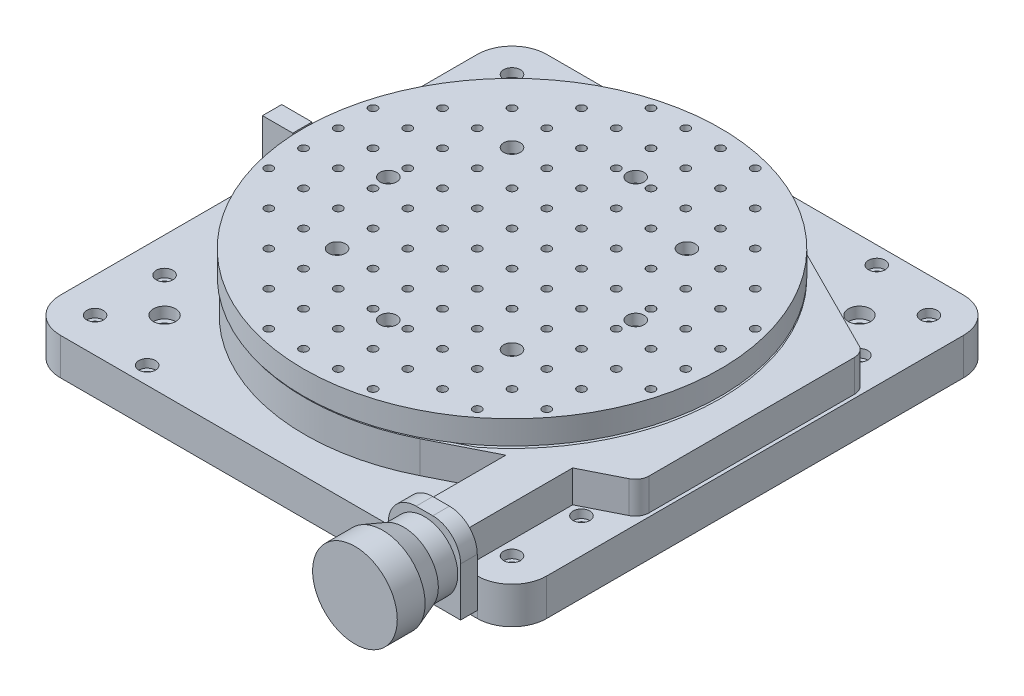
SolidWorks part; units mm, degrees
ref_plane "Front Plane" through (0, 0, 0) normal (0, 0, 1) x (1, 0, 0)
ref_plane "Top Plane" through (0, 0, 0) normal (0, 1, 0) x (1, 0, 0)
ref_plane "Right Plane" through (0, 0, 0) normal (1, 0, 0) x (0, 0, -1)
sketch "Sketch1" plane through (0, 0, 0) normal (0, 1, 0) x (1, 0, 0)
  line L1 (-150, 175) -> (150, 175)
  line L2 (-175, 150) -> (-175, -150)
  line L3 (-150, -175) -> (91, -175)
  line L4 (175, 150) -> (175, -130)
  line L5 (-175, 175) -> (175, -175) construction
  line L6 (-175, -175) -> (175, 175) construction
  line L9 (175, -130) -> (91, -130)
  line L10 (91, -175) -> (91, -130)
  arc A0 (-150, -175) -> (-175, -150) centre (-150, -150) cw
  arc A1 (175, 150) -> (150, 175) centre (150, 150) ccw
  arc A2 (-150, 175) -> (-175, 150) centre (-150, 150) ccw
  circle A3 centre (0, 0) radius 45
  point P0 (0, 0)
  dimension "D3" = 25
  dimension "D6" = 90
  dimension "D1" = 350
  dimension "D2" = 350
  dimension "D4" = 84
  dimension "D5" = 45
extrude "Boss-Extrude1" add sketch "Sketch1" along normal blind 26.5
sketch "Sketch2" plane through (0, 26.5, 0) normal (0, 1, 0) x (1, 0, 0)
  line L0 (172.5, 73.8373) -> (172.5, -73.8373)
  line L1 (175, -130) -> (175, 150) construction
  line L2 (66.9742, 133.0994) -> (166.9949, 82.7701)
  line L3 (66.9742, -133.0994) -> (166.9949, -82.7701)
  line L4 (66.0752, -131.3129) -> (166.0959, -80.9835)
  line L5 (170.5, 73.8373) -> (170.5, -73.8373)
  line L6 (66.0752, 131.3129) -> (166.0959, 80.9835)
  arc A0 (66.9742, 133.0994) -> (66.9742, -133.0994) centre (0, 0) ccw
  arc A1 (166.9949, 82.7701) -> (172.5, 73.8373) centre (162.5, 73.8373) cw
  arc A2 (172.5, -73.8373) -> (166.9949, -82.7701) centre (162.5, -73.8373) cw
  arc A3 (66.0752, 131.3129) -> (66.0752, -131.3129) centre (0, 0) ccw
  arc A4 (170.5, -73.8373) -> (166.0959, -80.9835) centre (162.5, -73.8373) cw
  arc A5 (166.0959, 80.9835) -> (170.5, 73.8373) centre (162.5, 73.8373) cw
  point P11 (172.5, 80)
  point P14 (172.5, -80)
  dimension "D1" = 298
  dimension "D5" = 10
  dimension "D2" = 2.5
  dimension "D3" = 80
  dimension "D4" = 80
  dimension "D6" = 2
extrude "Boss-Extrude2" add sketch "Sketch2" along normal blind 23
sketch "Sketch3" plane through (0, 26.5, 0) normal (0, 1, 0) x (1, 0, 0)
  circle A0 centre (0, 0) radius 45
  circle A1 centre (0, 0) radius 55.7582
extrude "Boss-Extrude3" add sketch "Sketch3" along normal blind 24.5
sketch "Sketch4" plane through (0, 51, 0) normal (0, 1, 0) x (1, 0, 0)
  circle A0 centre (0, 0) radius 150
  circle A1 centre (0, 0) radius 45
  dimension "D1" = 300
extrude "Boss-Extrude4" add sketch "Sketch4" along normal blind 17
sketch "Sketch5" plane through (0, 49.5, 0) normal (0, 1, 0) x (1, 0, 0)
  line L3 (66.9742, -133.0994) -> (166.9949, -82.7701)
  line L4 (172.5, -73.8373) -> (172.5, 73.8373)
  line L5 (166.9949, 82.7701) -> (66.9742, 133.0994)
  line L6 (82.4205, -125.327) -> (166.9949, -82.7701)
  line L7 (172.5, -73.8373) -> (172.5, 73.8373)
  line L8 (166.9949, 82.7701) -> (82.4205, 125.327)
  circle A1 centre (0, 0) radius 150
  arc A2 (82.4205, -125.327) -> (82.4205, 125.327) centre (0, 0) ccw
  arc A3 (66.9742, 133.0994) -> (66.9742, -133.0994) centre (0, 0) ccw
  arc A4 (166.9949, -82.7701) -> (172.5, -73.8373) centre (162.5, -73.8373) ccw
  arc A5 (172.5, 73.8373) -> (166.9949, 82.7701) centre (162.5, 73.8373) ccw
  arc A7 (166.9949, -82.7701) -> (172.5, -73.8373) centre (162.5, -73.8373) ccw
  arc A8 (172.5, 73.8373) -> (166.9949, 82.7701) centre (162.5, 73.8373) ccw
  dimension "D1" = 0
  dimension "D2" = 0
extrude "Boss-Extrude6" add sketch "Sketch5" against normal blind 2
sketch "Sketch7" plane through (0, 0, 130) normal (0, 0, 1) x (1, 0, 0)
  line L0 (91, 0) -> (175, 0) construction
  line L1 (99, 64) -> (149, 64)
  line L2 (94, 59) -> (94, 6)
  line L3 (99, 1) -> (149, 1)
  line L4 (154, 59) -> (154, 6)
  line L7 (175, 26.5) -> (175, 0) construction
  arc A0 (154, 59) -> (149, 64) centre (149, 59) ccw
  arc A1 (99, 64) -> (94, 59) centre (99, 59) ccw
  arc A2 (94, 6) -> (99, 1) centre (99, 6) ccw
  arc A3 (149, 1) -> (154, 6) centre (149, 6) ccw
  point P0 (124, 32.5)
  point P11 (154, 64)
  point P18 (154, 1)
  dimension "D6" = 5
  dimension "D1" = 32.5
  dimension "D2" = 31.5
  dimension "D3" = 63
  dimension "D4" = 51
  dimension "D5" = 60
extrude "Boss-Extrude7" add sketch "Sketch7" along normal blind 21
sketch "Sketch8" plane through (0, 0, 151) normal (0, 0, 1) x (1, 0, 0)
  line L1 (97.1361, 2.8267) -> (150.8639, 2.8267)
  line L2 (95.1361, 4.8267) -> (95.1361, 60.1733)
  line L3 (97.1361, 62.1733) -> (150.8639, 62.1733)
  line L4 (152.8639, 4.8267) -> (152.8639, 60.1733)
  line L5 (95.1361, 2.8267) -> (152.8639, 62.1733) construction
  line L6 (95.1361, 62.1733) -> (152.8639, 2.8267) construction
  arc A0 (154, 59) -> (149, 64) centre (149, 59) ccw construction
  arc A1 (95.1361, 4.8267) -> (97.1361, 2.8267) centre (97.1361, 4.8267) ccw
  arc A2 (150.8639, 2.8267) -> (152.8639, 4.8267) centre (150.8639, 4.8267) ccw
  arc A3 (152.8639, 60.1733) -> (150.8639, 62.1733) centre (150.8639, 60.1733) ccw
  arc A4 (97.1361, 62.1733) -> (95.1361, 60.1733) centre (97.1361, 60.1733) ccw
  point P0 (124, 32.5)
  dimension "D1" = 2
extrude "Boss-Extrude8" add sketch "Sketch8" along normal blind 75
sketch "Sketch9" plane through (154, 0, 0) normal (1, 0, 0) x (0, 0, -1)
  line L0 (-226, 4.8267) -> (-226, 60.1733) construction
  line L1 (-131.4165, 48.283) -> (-226, 48.283)
  line L2 (-131.4165, 48.283) -> (-131.4165, 18.283)
  line L3 (-131.4165, 18.283) -> (-226, 18.283)
  line L4 (-226, 48.283) -> (-226, 18.283)
  dimension "D1" = 30
extrude "Boss-Extrude9" add sketch "Sketch9" along normal blind 25
chamfer "Chamfer1" distance 3 angle 45 2 edges at (179, 18.283, 178.7082) (179, 48.283, 178.7082)
sketch "Sketch10" plane through (0, 26.5, 0) normal (0, 1, 0) x (1, 0, 0)
  line L1 (-125, -125) -> (125, -125) construction
  line L2 (-125, -125) -> (-125, 125) construction
  line L3 (-125, 125) -> (125, 125) construction
  line L4 (125, -125) -> (125, 125) construction
  circle A0 centre (-125, 125) radius 4.5
  circle A1 centre (125, 125) radius 4.5
  circle A2 centre (-125, -125) radius 4.5
  circle A3 centre (-150, 150) radius 3.25
  circle A4 centre (150, 150) radius 3.25
  circle A5 centre (-150, -150) radius 3.25
  circle A6 centre (-150, -100) radius 3.25
  circle A7 centre (-150, 100) radius 3.25
  circle A8 centre (150, 100) radius 3.25
  circle A9 centre (150, -100) radius 3.25
  circle A10 centre (-100, -162.5) radius 3.25
  circle A11 centre (0, 0) radius 45 construction
  circle A12 centre (-100, 162.5) radius 3.25
  circle A13 centre (100, 162.5) radius 3.25
  point P0 (0, 0)
  point P9 (0, 0)
  dimension "D3" = 9
  dimension "D6" = 6.5
  dimension "D7" = 200
  dimension "D8" = 50
  dimension "D10" = 50
  dimension "D11" = 6.5
  dimension "D12" = 200
  dimension "D13" = 100
  dimension "D14" = 100
  dimension "D1" = 250
  dimension "D2" = 250
  dimension "D4" = 300
  dimension "D5" = 300
  dimension "D9" = 200
extrude "Cut-Extrude1" cut sketch "Sketch10" against normal blind 98
sketch "Sketch11" plane through (0, 26.5, 0) normal (0, 1, 0) x (1, 0, 0)
  circle A0 centre (-125, 125) radius 8
  circle A1 centre (125, 125) radius 8
  circle A2 centre (-125, -125) radius 8
  dimension "D1" = 16
  dimension "D2" = 16
  dimension "D3" = 16
extrude "Cut-Extrude2" cut sketch "Sketch11" against normal blind 8
sketch "Sketch12" plane through (0, 26.5, 0) normal (0, 1, 0) x (1, 0, 0)
  line L0 (0, 0) -> (0, -202.2688) construction
  circle A0 centre (-100, 162.5) radius 6
  circle A2 centre (-150, 100) radius 6
  circle A3 centre (-150, 150) radius 6
  circle A4 centre (100, 162.5) radius 6
  circle A5 centre (150, 150) radius 6
  circle A7 centre (150, 100) radius 6
  circle A8 centre (150, -100) radius 6
  circle A9 centre (-100, -162.5) radius 6
  circle A10 centre (-150, -150) radius 6
  circle A11 centre (-150, -100) radius 6
  dimension "D1" = 12
extrude "Cut-Extrude3" cut sketch "Sketch12" against normal blind 6
sketch "Sketch14" plane through (0, 68, 0) normal (0, 1, 0) x (1, 0, 0)
  circle A0 centre (0, 0) radius 89 construction
  circle A1 centre (0, 89) radius 3.5
  circle A2 centre (62.9325, 62.9325) radius 3.5
  circle A3 centre (89, 0) radius 3.5
  circle A4 centre (62.9325, -62.9325) radius 3.5
  circle A5 centre (0, -89) radius 3.5
  circle A6 centre (-62.9325, -62.9325) radius 3.5
  circle A7 centre (-89, 0) radius 3.5
  circle A8 centre (-62.9325, 62.9325) radius 3.5
  point P20 (0, 0)
  point P23 (0, 0)
  dimension "D1" = 178
  dimension "D2" = 7
  dimension "D3" = 8
extrude "Cut-Extrude4" cut sketch "Sketch14" against normal blind 18
sketch "Sketch15" plane through (0, 68, 0) normal (0, 1, 0) x (1, 0, 0)
  circle A0 centre (0, 89) radius 6
  circle A1 centre (62.9325, 62.9325) radius 6
  circle A2 centre (89, 0) radius 6
  circle A3 centre (62.9325, -62.9325) radius 6
  circle A4 centre (0, -89) radius 6
  circle A5 centre (-62.9325, -62.9325) radius 6
  circle A6 centre (-89, 0) radius 6
  circle A7 centre (-62.9325, 62.9325) radius 6
  circle A8 centre (89, 0) radius 6
  circle A9 centre (0, -89) radius 6
  circle A10 centre (-89, 0) radius 6
  point P19 (0, 0)
  point P27 (0, 0)
  dimension "D1" = 12
  dimension "D2" = 8
  dimension "D3" = 4
sketch "Sketch16" plane through (0, 68, 0) normal (0, 1, 0) x (1, 0, 0)
  line L0 (-37.5, 37.5) -> (37.5, 37.5) construction
  line L1 (-37.5, 37.5) -> (-37.5, -37.5) construction
  line L2 (-37.5, -37.5) -> (37.5, -37.5) construction
  line L3 (37.5, 37.5) -> (37.5, -37.5) construction
  line L4 (-37.5, 37.5) -> (37.5, -37.5) construction
  line L5 (-37.5, -37.5) -> (37.5, 37.5) construction
  line L6 (-37.5, 12.5) -> (37.5, 12.5) construction
  line L7 (-37.5, -12.5) -> (37.5, -12.5) construction
  line L8 (-37.5, -37.5) -> (37.5, -37.5) construction
  line L9 (-37.5, -62.5) -> (37.5, -62.5) construction
  line L10 (-37.5, -87.5) -> (37.5, -87.5) construction
  line L11 (-37.5, -112.5) -> (37.5, -112.5) construction
  line L12 (-37.5, -137.5) -> (37.5, -137.5) construction
  circle A0 centre (-37.5, 37.5) radius 3
  circle A1 centre (37.5, 37.5) radius 3
  circle A2 centre (37.5, -37.5) radius 3
  circle A3 centre (-37.5, -37.5) radius 3
  circle A4 centre (0, 0) radius 45 construction
  circle A5 centre (-62.5, 37.5) radius 3
  circle A6 centre (-87.5, 37.5) radius 3
  circle A7 centre (-112.5, 37.5) radius 3
  circle A8 centre (-137.5, 37.5) radius 3
  circle A10 centre (-87.5, 62.5) radius 3
  circle A11 centre (-112.5, 62.5) radius 3
  circle A12 centre (-12.5, 37.5) radius 3
  circle A13 centre (-62.5, 87.5) radius 3
  circle A14 centre (-87.5, 87.5) radius 3
  circle A15 centre (-12.5, 62.5) radius 3
  circle A16 centre (-12.5, 87.5) radius 3
  circle A17 centre (-62.5, 112.5) radius 3
  circle A18 centre (-12.5, 112.5) radius 3
  circle A19 centre (-12.5, 137.5) radius 3
  circle A20 centre (12.5, 37.5) radius 3
  circle A21 centre (12.5, 62.5) radius 3
  circle A22 centre (12.5, 87.5) radius 3
  circle A23 centre (12.5, 112.5) radius 3
  circle A24 centre (12.5, 137.5) radius 3
  circle A25 centre (-37.5, 62.5) radius 3
  circle A26 centre (-37.5, 87.5) radius 3
  circle A27 centre (-37.5, 112.5) radius 3
  circle A28 centre (-37.5, -137.5) radius 3
  circle A29 centre (-137.5, 137.5) radius 3
  circle A30 centre (-112.5, 137.5) radius 3
  circle A31 centre (-87.5, 137.5) radius 3
  circle A32 centre (-62.5, 137.5) radius 3
  circle A33 centre (-112.5, 112.5) radius 3
  circle A34 centre (-137.5, 112.5) radius 3
  circle A35 centre (-137.5, 87.5) radius 3
  circle A36 centre (-137.5, 62.5) radius 3
  circle A37 centre (-112.5, 87.5) radius 3
  circle A38 centre (-87.5, 112.5) radius 3
  circle A39 centre (37.5, 37.5) radius 3
  circle A40 centre (37.5, 62.5) radius 3
  circle A41 centre (37.5, 87.5) radius 3
  circle A42 centre (37.5, 112.5) radius 3
  circle A43 centre (37.5, -137.5) radius 3
  circle A44 centre (62.5, 37.5) radius 3
  circle A46 centre (62.5, 87.5) radius 3
  circle A47 centre (62.5, 112.5) radius 3
  circle A48 centre (-37.5, 12.5) radius 3
  circle A49 centre (87.5, 37.5) radius 3
  circle A50 centre (87.5, 62.5) radius 3
  circle A51 centre (87.5, 87.5) radius 3
  circle A52 centre (37.5, 12.5) radius 3
  circle A53 centre (-62.5, 12.5) radius 3
  circle A54 centre (112.5, 37.5) radius 3
  circle A55 centre (112.5, 62.5) radius 3
  circle A56 centre (-87.5, 12.5) radius 3
  circle A57 centre (-112.5, 12.5) radius 3
  circle A58 centre (-137.5, 12.5) radius 3
  circle A59 centre (137.5, 37.5) radius 3
  circle A60 centre (-12.5, 12.5) radius 3
  circle A61 centre (12.5, 12.5) radius 3
  circle A62 centre (37.5, 12.5) radius 3
  circle A63 centre (62.5, 12.5) radius 3
  circle A68 centre (87.5, 112.5) radius 3
  circle A69 centre (112.5, 112.5) radius 3
  circle A70 centre (137.5, 112.5) radius 3
  circle A71 centre (112.5, 87.5) radius 3
  circle A72 centre (137.5, 87.5) radius 3
  circle A73 centre (137.5, 62.5) radius 3
  circle A74 centre (87.5, 12.5) radius 3
  circle A75 centre (112.5, 12.5) radius 3
  circle A76 centre (137.5, 12.5) radius 3
  circle A77 centre (-37.5, -12.5) radius 3
  circle A78 centre (37.5, -12.5) radius 3
  circle A79 centre (-62.5, -12.5) radius 3
  circle A80 centre (-87.5, -12.5) radius 3
  circle A81 centre (-112.5, -12.5) radius 3
  circle A82 centre (-137.5, -12.5) radius 3
  circle A83 centre (-12.5, -12.5) radius 3
  circle A84 centre (12.5, -12.5) radius 3
  circle A85 centre (37.5, -12.5) radius 3
  circle A86 centre (62.5, -12.5) radius 3
  circle A87 centre (87.5, -12.5) radius 3
  circle A88 centre (112.5, -12.5) radius 3
  circle A89 centre (137.5, -12.5) radius 3
  circle A90 centre (-37.5, -37.5) radius 3
  circle A91 centre (37.5, -37.5) radius 3
  circle A92 centre (-62.5, -37.5) radius 3
  circle A93 centre (-87.5, -37.5) radius 3
  circle A94 centre (-112.5, -37.5) radius 3
  circle A95 centre (-137.5, -37.5) radius 3
  circle A96 centre (-12.5, -37.5) radius 3
  circle A97 centre (12.5, -37.5) radius 3
  circle A98 centre (37.5, -37.5) radius 3
  circle A99 centre (62.5, -37.5) radius 3
  circle A100 centre (87.5, -37.5) radius 3
  circle A101 centre (112.5, -37.5) radius 3
  circle A102 centre (137.5, -37.5) radius 3
  circle A103 centre (-37.5, -62.5) radius 3
  circle A104 centre (37.5, -62.5) radius 3
  circle A106 centre (-87.5, -62.5) radius 3
  circle A107 centre (-112.5, -62.5) radius 3
  circle A108 centre (-37.5, 137.5) radius 3
  circle A109 centre (-12.5, -62.5) radius 3
  circle A110 centre (12.5, -62.5) radius 3
  circle A111 centre (37.5, -62.5) radius 3
  circle A113 centre (87.5, -62.5) radius 3
  circle A114 centre (112.5, -62.5) radius 3
  circle A115 centre (37.5, 137.5) radius 3
  circle A116 centre (-37.5, -87.5) radius 3
  circle A117 centre (37.5, -87.5) radius 3
  circle A118 centre (-62.5, -87.5) radius 3
  circle A119 centre (-87.5, -87.5) radius 3
  circle A122 centre (-12.5, -87.5) radius 3
  circle A123 centre (12.5, -87.5) radius 3
  circle A124 centre (37.5, -87.5) radius 3
  circle A125 centre (62.5, -87.5) radius 3
  circle A126 centre (87.5, -87.5) radius 3
  circle A127 centre (112.5, -87.5) radius 3
  circle A129 centre (-37.5, -112.5) radius 3
  circle A130 centre (37.5, -112.5) radius 3
  circle A131 centre (-62.5, -112.5) radius 3
  circle A135 centre (-12.5, -112.5) radius 3
  circle A136 centre (12.5, -112.5) radius 3
  circle A137 centre (37.5, -112.5) radius 3
  circle A138 centre (62.5, -112.5) radius 3
  circle A139 centre (87.5, -112.5) radius 3
  circle A148 centre (-12.5, -137.5) radius 3
  circle A149 centre (12.5, -137.5) radius 3
  circle A155 centre (-137.5, -62.5) radius 3
  circle A156 centre (-137.5, -87.5) radius 3
  circle A157 centre (-137.5, -112.5) radius 3
  circle A158 centre (-137.5, -137.5) radius 3
  circle A159 centre (-112.5, -87.5) radius 3
  circle A160 centre (-112.5, -112.5) radius 3
  circle A161 centre (-112.5, -137.5) radius 3
  circle A162 centre (-87.5, -112.5) radius 3
  circle A163 centre (-87.5, -137.5) radius 3
  circle A164 centre (-62.5, -137.5) radius 3
  circle A165 centre (-37.5, -137.5) radius 3
  circle A166 centre (-37.5, 137.5) radius 3
  circle A167 centre (37.5, -137.5) radius 3
  circle A168 centre (37.5, -137.5) radius 3
  circle A169 centre (62.5, -137.5) radius 3
  circle A170 centre (87.5, -137.5) radius 3
  circle A171 centre (112.5, -137.5) radius 3
  circle A172 centre (137.5, -137.5) radius 3
  circle A173 centre (112.5, -112.5) radius 3
  circle A174 centre (137.5, -112.5) radius 3
  circle A175 centre (137.5, -62.5) radius 3
  circle A176 centre (137.5, -87.5) radius 3
  circle A177 centre (62.5, 62.5) radius 3
  circle A178 centre (62.5, -62.5) radius 3
  circle A179 centre (-62.5, -62.5) radius 3
  circle A180 centre (-62.5, 62.5) radius 3
  point P0 (0, 0)
  dimension "D3" = 6
  dimension "D5" = 0
  dimension "D10" = 6
  dimension "D11" = 6
  dimension "D12" = 6
  dimension "D13" = 6
  dimension "D1" = 75
  dimension "D2" = 75
  dimension "D4" = 0
  dimension "D6" = 5
  dimension "D7" = 5
  dimension "D8" = 8
  dimension "D9" = 8
extrude "Cut-Extrude5" cut sketch "Sketch15" against normal blind 8 contours A7 | A6 | A5 | A4 | A3 | A2 | A1 | A0
extrude "Cut-Extrude6" cut sketch "Sketch16" against normal blind 8
sketch "Sketch17" plane through (0, 26.5, 0) normal (0, 1, 0) x (1, 0, 0)
  line L0 (-150.807, 6.9298) -> (-150.807, -6.9298)
  line L1 (-172.6003, -6.9298) -> (-150.807, -6.9298)
  line L2 (-172.6003, -6.9298) -> (-172.6003, 6.9298)
  line L3 (-172.6003, 6.9298) -> (-150.807, 6.9298)
  line L5 (-172.6003, -6.9298) -> (-149.8398, 6.9298) construction
  line L6 (-172.6003, 6.9298) -> (-149.8398, -6.9298) construction
  circle A0 centre (0, 0) radius 150 construction
  point P0 (-161.2201, 0)
extrude "Boss-Extrude11" add sketch "Sketch17" along normal up to surface (41.5 mm away)
sketch "Sketch19" plane through (0, 0, 0) normal (0, -1, 0) x (1, 0, 0)
  line L1 (91, 130) -> (192.8124, 130)
  line L2 (91, 130) -> (91, 229.8076)
  line L3 (91, 229.8076) -> (192.8124, 229.8076)
  line L4 (192.8124, 130) -> (192.8124, 229.8076)
extrude "Cut-Extrude7" cut sketch "Sketch19" against normal blind 107
sketch "Sketch20" plane through (0, 26.5, 0) normal (0, 1, 0) x (1, 0, 0)
  line L1 (91, -130) -> (175, -130)
  line L2 (91, -130) -> (91, -175)
  line L3 (91, -175) -> (175, -175)
  line L4 (175, -130) -> (175, -175)
extrude "Boss-Extrude12" add sketch "Sketch20" against normal up to surface (26.5 mm away)
fillet "Fillet1" radius 25 1 edges at (175, 13.25, 175)
sketch "Sketch21" plane through (0, 0, 175) normal (0, 0, 1) x (1, 0, 0)
  line L0 (124, 93.8972) -> (124, -19.549) construction
  line L1 (87.1422, 32.5) -> (186.5615, 32.5) construction
  line L2 (150, 0) -> (175, 0) construction
  line L8 (98, 65) -> (150, 0) construction
  line L9 (98, 0) -> (150, 65) construction
  line L10 (98, 5) -> (150, 5)
  line L11 (98, 5) -> (98, 60)
  line L12 (98, 60) -> (150, 60)
  line L13 (150, 5) -> (150, 60)
  line L14 (98, 5) -> (150, 60) construction
  line L15 (98, 60) -> (150, 5) construction
  point P7 (124, 32.5)
  point P13 (124, 32.5)
  dimension "D1" = 124
  dimension "D2" = 32.5
  dimension "D3" = 52
  dimension "D4" = 55
extrude "Boss-Extrude13" add sketch "Sketch21" along normal blind 12
sketch "Sketch22" plane through (0, 0, 187) normal (0, 0, 1) x (1, 0, 0)
  line L0 (98, 60) -> (150, 5) construction
  line L2 (108, 15.5) -> (140, 15.5)
  line L3 (108, 15.5) -> (108, 49.5)
  line L4 (108, 49.5) -> (140, 49.5)
  line L5 (140, 15.5) -> (140, 49.5)
  line L6 (108, 15.5) -> (140, 49.5) construction
  line L7 (108, 49.5) -> (140, 15.5) construction
  point P4 (124, 32.5)
  dimension "D1" = 32
extrude "Boss-Extrude14" add sketch "Sketch22" against normal up to surface (74.5443 mm away)
sketch "Sketch24" plane through (0, 0, 187) normal (0, 0, 1) x (1, 0, 0)
  line L0 (98, 60) -> (150, 5) construction
  line L1 (98, 60) -> (98, 5) construction
  circle A0 centre (124, 32.5) radius 24
  dimension "D1" = 48
extrude "Boss-Extrude15" add sketch "Sketch24" along normal blind 15
sketch "Sketch25" plane through (0, 0, 202) normal (0, 0, 1) x (1, 0, 0)
  circle A0 centre (124, 32.5) radius 25
  dimension "D1" = 50
extrude "Boss-Extrude16" add sketch "Sketch25" along normal blind 15 draft 20
sketch "Sketch26" plane through (0, 0, 217) normal (0, 0, 1) x (1, 0, 0)
  circle A0 centre (124, 32.5) radius 30.4596
extrude "Boss-Extrude17" add sketch "Sketch26" along normal blind 20
fillet "Fillet4" radius 20 2 edges at (98, 60, 181) (150, 60, 181)
sketch "Sketch27" plane through (0, 68, 0) normal (0, 1, 0) x (1, 0, 0)
  circle A0 centre (0, 0) radius 45
extrude "Boss-Extrude18" add sketch "Sketch27" against normal blind 12
sketch "Sketch28" plane through (0, 68, 0) normal (0, 1, 0) x (1, 0, 0)
  line L0 (-12.5, 62.5) -> (-12.5, -62.5) construction
  line L2 (-37.5, 37.5) -> (-37.5, -37.5) construction
  line L3 (-37.5, -37.5) -> (37.5, -37.5) construction
  line L4 (37.5, -37.5) -> (37.5, -32.8971) construction
  line L5 (37.5, 37.5) -> (37.5, -37.5) construction
  line L6 (37.5, -37.5) -> (37.5, 37.5) construction
  line L7 (37.5, 37.5) -> (-37.5, 37.5) construction
  line L9 (12.5, 62.5) -> (12.5, -62.5) construction
  line L11 (62.5, -12.5) -> (-62.5, -12.5) construction
  line L12 (-62.5, -12.5) -> (-62.5, 12.5) construction
  line L13 (-62.5, 12.5) -> (62.5, 12.5) construction
  circle A0 centre (-37.5, 37.5) radius 3
  circle A1 centre (-12.5, 37.5) radius 3
  circle A2 centre (12.5, 37.5) radius 3
  circle A3 centre (12.5, 12.5) radius 3
  circle A4 centre (-12.5, 12.5) radius 3
  circle A5 centre (-37.5, 12.5) radius 3
  circle A6 centre (-37.5, -12.5) radius 3
  circle A7 centre (-12.5, -12.5) radius 3
  circle A8 centre (12.5, -12.5) radius 3
  circle A9 centre (37.5, -12.5) radius 3
  circle A10 centre (37.5, 12.5) radius 3
  circle A11 centre (12.5, -37.5) radius 3
  circle A12 centre (-12.5, -37.5) radius 3
  dimension "D1" = 6
extrude "Cut-Extrude8" cut sketch "Sketch28" against normal blind 10
sketch "Sketch30" plane through (0, 26.5, 0) normal (0, 1, 0) x (1, 0, 0)
  line L0 (0, -89) -> (0, -210.3448) construction
  circle A2 centre (150, -150) radius 6
  circle A3 centre (100, -162.5) radius 6
extrude "Cut-Extrude9" cut sketch "Sketch30" against normal blind 6
sketch "Sketch31" plane through (0, 20.5, 0) normal (0, 1, 0) x (1, 0, 0)
  circle A0 centre (100, -162.5) radius 3.25
  circle A1 centre (150, -150) radius 3.25
  dimension "D1" = 6.5
  dimension "D2" = 6.5
extrude "Cut-Extrude10" cut sketch "Sketch31" against normal blind 66
sketch "Sketch32" plane through (0, 0, 0) normal (0, -1, 0) x (1, 0, 0)
  circle A0 centre (0, 0) radius 45
extrude "Boss-Extrude19" add sketch "Sketch32" against normal blind 10
